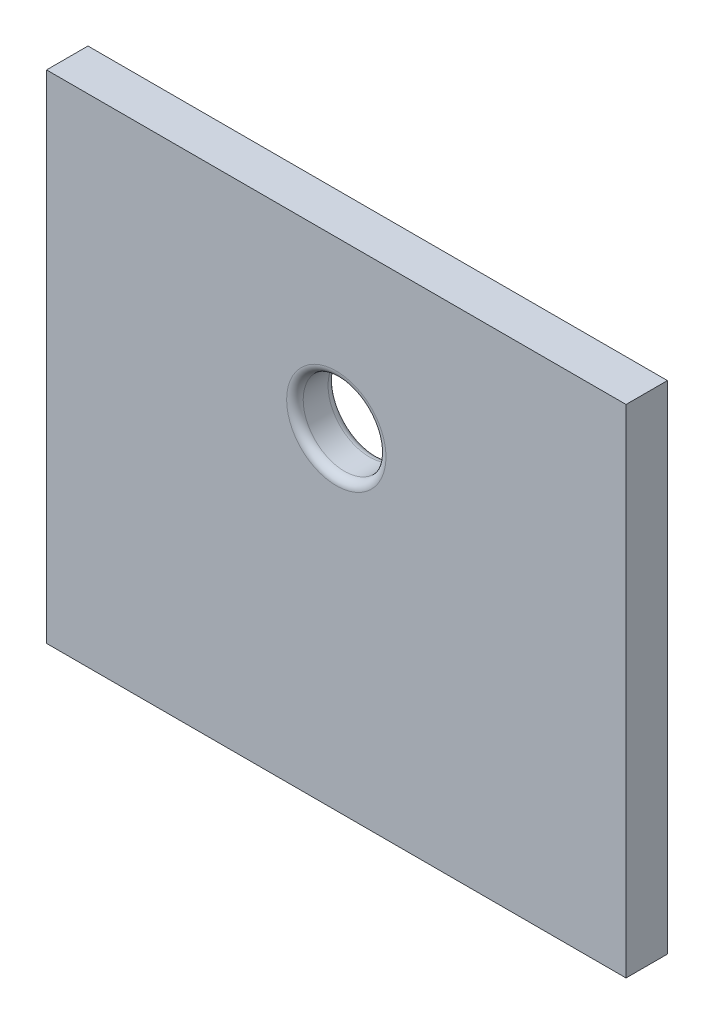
SolidWorks part; units mm, degrees
ref_plane "Piano frontale" through (0, 0, 0) normal (0, 0, 1) x (1, 0, 0)
ref_plane "Piano superiore" through (0, 0, 0) normal (0, 1, 0) x (1, 0, 0)
ref_plane "Piano destro" through (0, 0, 0) normal (1, 0, 0) x (0, 0, -1)
sketch "Schizzo1" plane through (0, 0, 0) normal (0, 0, 1) x (1, 0, 0)
  line L0 (0, -30) -> (0, 58.2922) construction
  line L1 (-35, -30) -> (35, -30)
  line L2 (-35, -30) -> (-35, 30)
  line L3 (-35, 30) -> (35, 30)
  line L4 (35, -30) -> (35, 30)
  line L5 (-35, -30) -> (35, 30) construction
  line L6 (-35, 30) -> (35, -30) construction
  circle A0 centre (0, 10) radius 5
  point P0 (0, 0)
  dimension "D3" = 40
  dimension "D4" = 10
  dimension "D1" = 70
  dimension "D2" = 60
extrude "Estrusione-Estrusione1" add sketch "Schizzo1" along normal blind 5
ref_plane "Piano1" through (0, 0, 0) normal (1, 0, 0) x (0, 0, -1)
fillet "Raccordo1" radius 1 2 edges at (5, 10, 0) (5, 10, 5)
